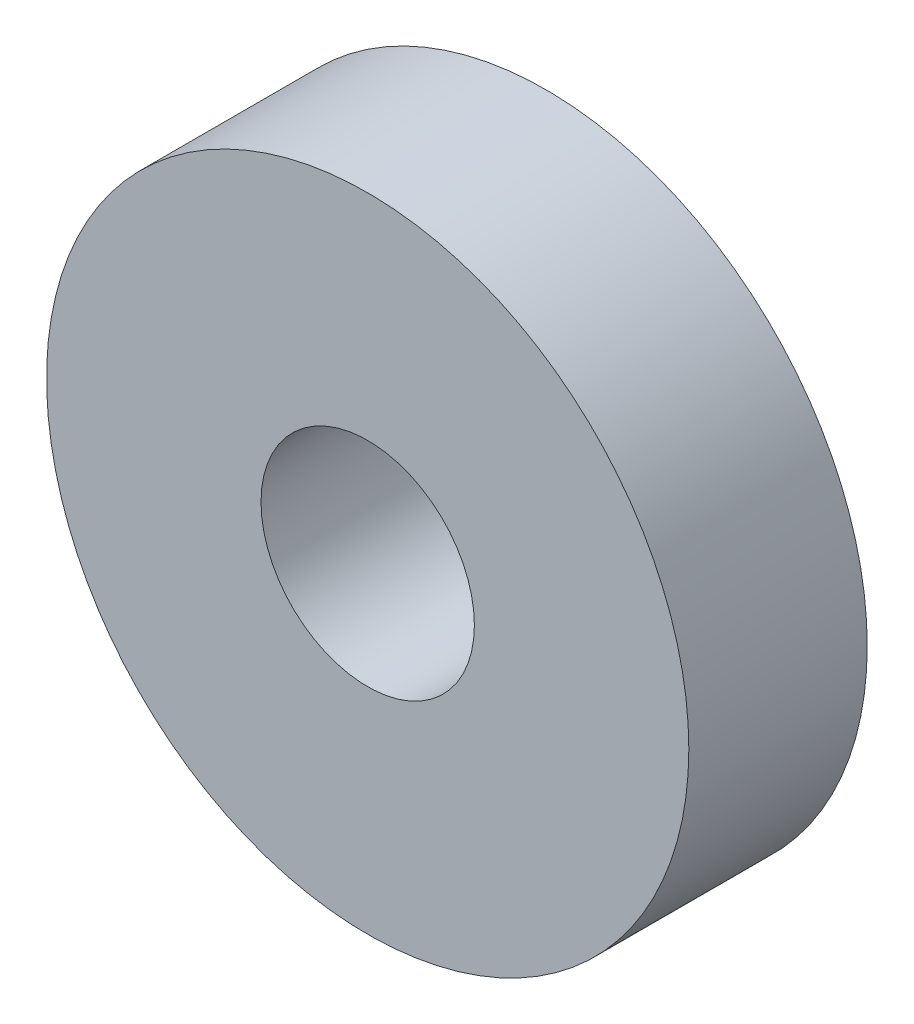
SolidWorks part; units mm, degrees
ref_plane "Front Plane" through (0, 0, 0) normal (0, 0, 1) x (1, 0, 0)
ref_plane "Top Plane" through (0, 0, 0) normal (0, 1, 0) x (1, 0, 0)
ref_plane "Right Plane" through (0, 0, 0) normal (1, 0, 0) x (0, 0, -1)
sketch "Sketch2" plane through (0, 0, 0) normal (0, 0, 1) x (1, 0, 0)
  circle A0 centre (0, 0) radius 5.715
  circle A1 centre (0, 0) radius 1.8986
  dimension "D1" = 3.7973
  dimension "D2" = 11.43
extrude "Boss-Extrude1" add sketch "Sketch2" along normal blind 3.175
